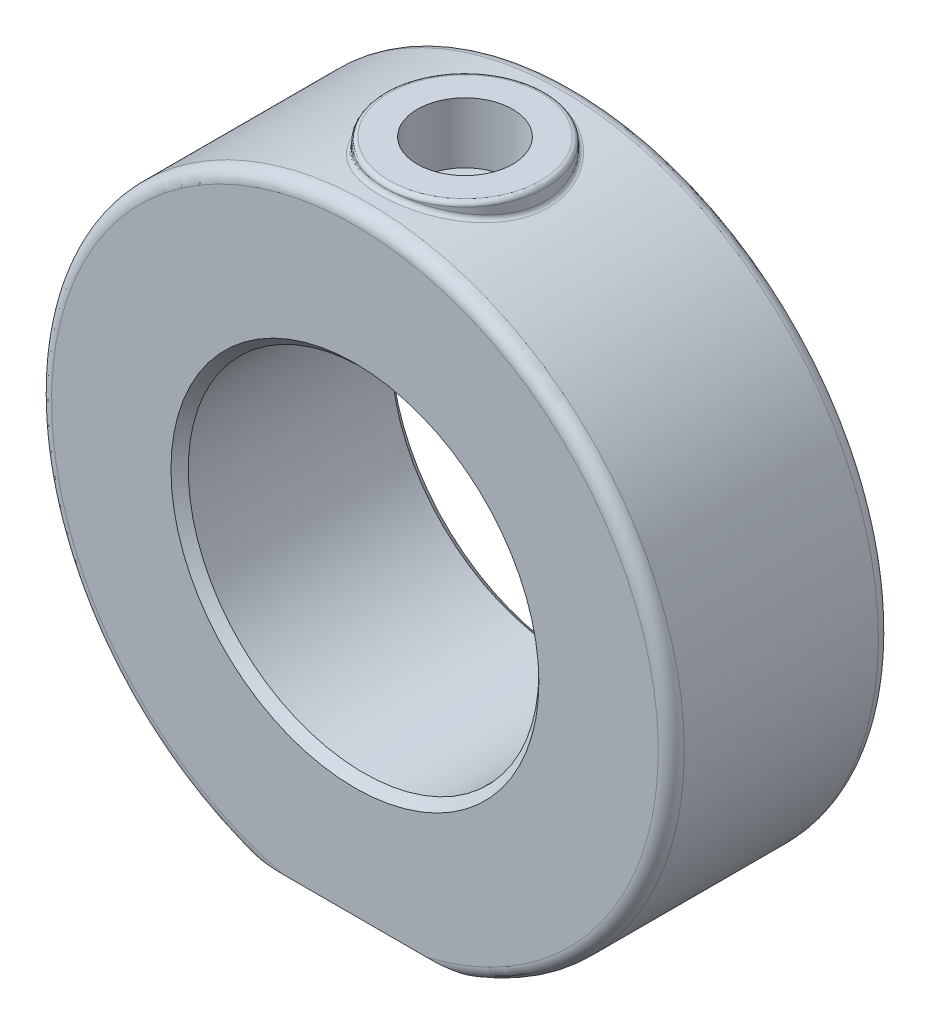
SolidWorks part; units mm, degrees
ref_plane "Front Plane" through (0, 0, 0) normal (0, 0, 1) x (1, 0, 0)
ref_plane "Top Plane" through (0, 0, 0) normal (0, 1, 0) x (1, 0, 0)
ref_plane "Right Plane" through (0, 0, 0) normal (1, 0, 0) x (0, 0, -1)
sketch "Sketch1" plane through (0, 0, 0) normal (0, 0, 1) x (1, 0, 0)
  circle A0 centre (0, 0) radius 73
  circle A1 centre (0, 0) radius 40.45
  dimension "D1" = 146
  dimension "D2" = 80.9
extrude "Boss-Extrude1" add sketch "Sketch1" along normal blind 50.8
fillet "Fillet1" radius 3 2 edges at (73, 0, 0) (73, 0, 50.8)
ref_plane "Plane1" through (0, 75, 0) normal (0, 1, 0) x (1, 0, 0)
sketch "Sketch2" plane through (0, 75, 0) normal (0, 1, 0) x (1, 0, 0)
  circle A0 centre (0, -25.4) radius 18.5
  dimension "D1" = 37
  dimension "D2" = 25.4
extrude "Boss-Extrude2" add sketch "Sketch2" against normal up to surface (2 mm away)
fillet "Fillet2" radius 1 2 edges at (-3.6011, 72.9111, 7.2539) (0, 75, 43.9)
sketch "Sketch3" plane through (0, 75, 0) normal (0, 1, 0) x (1, 0, 0)
  circle A0 centre (0, -25.4) radius 11
  dimension "D1" = 22
extrude "Cut-Extrude1" cut sketch "Sketch3" against normal blind 14
sketch "Sketch4" plane through (0, 61, 0) normal (0, 1, 0) x (1, 0, 0)
  circle A0 centre (0, -25.4) radius 4.5
  dimension "D1" = 9
extrude "Cut-Extrude2" cut sketch "Sketch4" against normal blind 34
ref_plane "Plane2" through (0, -68, 0) normal (0, 1, 0) x (1, 0, 0)
sketch "Sketch5" plane through (0, -68, 0) normal (0, 1, 0) x (1, 0, 0)
  line L1 (-38.7308, 26.1882) -> (38.7308, 26.1882)
  line L2 (-38.7308, 26.1882) -> (-38.7308, -76.9882)
  line L3 (-38.7308, -76.9882) -> (38.7308, -76.9882)
  line L4 (38.7308, 26.1882) -> (38.7308, -76.9882)
  line L5 (-38.7308, 26.1882) -> (38.7308, -76.9882) construction
  line L6 (-38.7308, -76.9882) -> (38.7308, 26.1882) construction
  point P0 (0, -25.4)
extrude "Cut-Extrude3" cut sketch "Sketch5" against normal blind 34
sketch "Sketch6" plane through (0, -68, 0) normal (0, -1, 0) x (1, 0, 0)
  circle A0 centre (0, 25.4) radius 5
  dimension "D1" = 10
  dimension "D2" = 25.4
extrude "Cut-Extrude4" cut sketch "Sketch6" against normal blind 5
chamfer "Chamfer1" distance 2 angle 45 2 edges at (40.45, 0, 0) (40.45, 0, 50.8)
ref_plane "Plane3" through (-68, 0, 0) normal (1, 0, 0) x (0, 0, -1)
sketch "Sketch7" plane through (-68, 0, 0) normal (1, 0, 0) x (0, 0, -1)
  circle A0 centre (-25.4, -32) radius 18
  dimension "D1" = 36
  dimension "D2" = 32
  dimension "D3" = 25.4
extrude "Boss-Extrude3" add sketch "Sketch7" along normal up to next
fillet "Fillet3" radius 1 3 edges at (-68, -26.5518, 25.4) (-53.2439, -49.9408, 23.9419) (-68, -50, 25.4)
